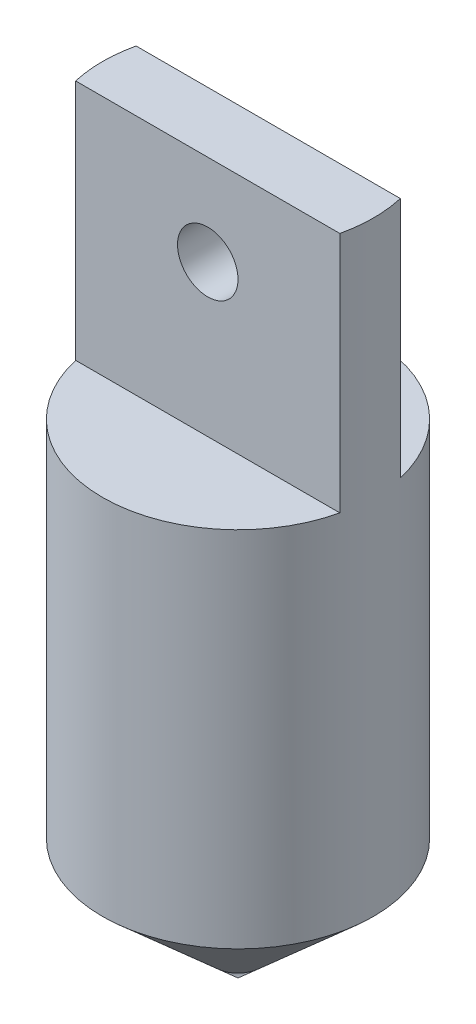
SolidWorks part; units mm, degrees
ref_plane "Alzado" through (0, 0, 0) normal (0, 0, 1) x (1, 0, 0)
ref_plane "Planta" through (0, 0, 0) normal (0, 1, 0) x (1, 0, 0)
ref_plane "Vista lateral" through (0, 0, 0) normal (1, 0, 0) x (0, 0, -1)
sketch "Croquis1" plane through (0, 0, 0) normal (0, 0, 1) x (1, 0, 0)
  line L0 (0, -60) -> (22.4002, -40)
  line L1 (0, 60) -> (22.4002, 60)
  line L2 (0, 60) -> (0, -60)
  line L4 (22.4002, 60) -> (22.4002, -40)
  line L5 (0, 0) -> (81.6327, 0) construction
  point P4 (0, 0)
  dimension "D1" = 20
  dimension "D2" = 41.76
  dimension "D3" = 120
revolve "Revolución1" add sketch "Croquis1" angle 360 about L2
sketch "Croquis2" plane through (0, 0, 0) normal (0, 0, 1) x (1, 0, 0)
  line L0 (22.4002, -40) -> (22.4002, 60) construction
  line L1 (-22.4002, 60) -> (22.4002, 60)
  line L2 (-22.4002, 60) -> (-22.4002, 20)
  line L3 (-22.4002, 20) -> (22.4002, 20)
  line L4 (22.4002, 60) -> (22.4002, 20)
  dimension "D1" = 40
extrude "Cortar-Extruir1" cut sketch "Croquis2" against normal through all from offset 5
mirror "Simetría1" about plane through (0, 0, 0) normal (0, 0, 1) of "Cortar-Extruir1"
sketch "Croquis3" plane through (0, 0, 5) normal (0, 0, 1) x (1, 0, 0)
  line L0 (21.8351, 20) -> (-21.8351, 20) construction
  circle A0 centre (0, 45) radius 5
  point P2 (0, 0)
  point P4 (0, 40.1563)
  dimension "D1" = 10
  dimension "D2" = 25
extrude "Cortar-Extruir2" cut sketch "Croquis3" against normal through all
